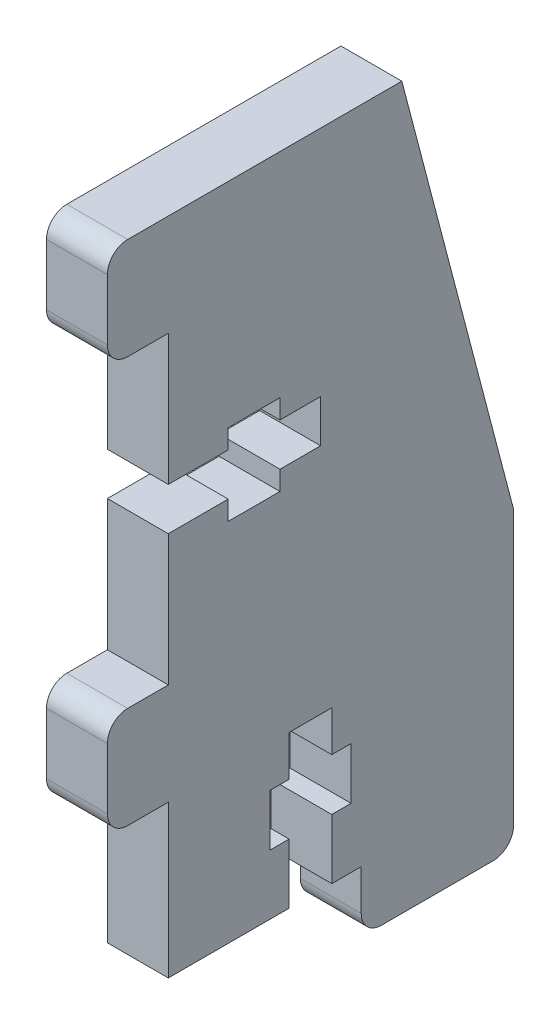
SolidWorks part; units mm, degrees
ref_plane "Спереди" through (0, 0, 0) normal (0, 0, 1) x (1, 0, 0)
ref_plane "Сверху" through (0, 0, 0) normal (0, 1, 0) x (1, 0, 0)
ref_plane "Справа" through (0, 0, 0) normal (1, 0, 0) x (0, 0, -1)
sketch "Эскиз1" plane through (0, 0, 0) normal (1, 0, 0) x (0, 0, -1)
  line L0 (23, 65) -> (34, 23)
  line L1 (0, 0) -> (34, 0)
  line L2 (0, 0) -> (0, 65)
  line L3 (0, 65) -> (23, 65)
  line L4 (34, 0) -> (34, 23)
  line L5 (0, 65) -> (-4, 65)
  line L6 (0, 65) -> (0, 55)
  line L7 (0, 55) -> (-4, 55)
  line L8 (-6, 63) -> (-6, 57)
  line L9 (0, 15) -> (-4, 15)
  line L10 (0, 15) -> (0, 25)
  line L11 (0, 25) -> (-4, 25)
  line L12 (-6, 17) -> (-6, 23)
  line L13 (0, 42.1) -> (15, 42.1)
  line L14 (0, 42.1) -> (0, 37.9)
  line L15 (0, 37.9) -> (15, 37.9)
  line L16 (15, 42.1) -> (15, 37.9)
  line L17 (5.9, 44) -> (11, 44)
  line L18 (5.9, 44) -> (5.9, 36)
  line L19 (5.9, 36) -> (11, 36)
  line L20 (11, 44) -> (11, 36)
  arc A0 (-4, 15) -> (-6, 17) centre (-4, 17) cw
  arc A1 (-4, 55) -> (-6, 57) centre (-4, 57) cw
  arc A2 (-4, 25) -> (-6, 23) centre (-4, 23) ccw
  arc A3 (-4, 65) -> (-6, 63) centre (-4, 63) ccw
  point P20 (15, 40)
  point P21 (11, 40)
  point P24 (-6, 15)
  point P27 (-6, 55)
  point P30 (-6, 25)
  point P33 (-6, 65)
  point P34 (23, 65)
  point P35 (34, 23)
extrude "Бобышка-Вытянуть1" add sketch "Эскиз1" along normal blind 6 contours L5 A3 L8 A1 L7 L2 | L11 A2 L12 A0 L9 L2 | L17 L20 L13 L16 L15 L19 L18 L2 L1 L4 L0 L3
sketch "Эскиз2" plane through (6, 0, 0) normal (1, 0, 0) x (0, 0, -1)
  line L0 (0, 0) -> (34, 0) construction
  line L1 (19, 0) -> (34, 0) construction
  line L2 (19, 0) -> (19, -4) construction
  line L3 (21, -6) -> (32, -6) construction
  line L4 (34, 0) -> (34, -4) construction
  line L6 (11.9, 0) -> (16.1, 0)
  line L7 (11.9, 0) -> (11.9, 15)
  line L8 (11.9, 15) -> (16.1, 15)
  line L9 (16.1, 0) -> (16.1, 15)
  line L10 (10, 11) -> (18, 11)
  line L11 (10, 11) -> (10, 5.9)
  line L12 (10, 5.9) -> (18, 5.9)
  line L13 (18, 11) -> (18, 5.9)
  arc A0 (32, -6) -> (34, -4) centre (32, -4) ccw construction
  arc A1 (19, -4) -> (21, -6) centre (21, -4) ccw construction
  point P15 (14, 15)
  point P16 (14, 11)
  point P19 (34, -6)
  point P23 (19, -6)
  dimension "D9" = 2
  dimension "D1" = 15
  dimension "D2" = 6
  dimension "D3" = 5
  dimension "D4" = 4
  dimension "D5" = 5.1
  dimension "D6" = 4.2
  dimension "D7" = 8
  dimension "D8" = 15
extrude "Вырез-Вытянуть1" cut sketch "Эскиз2" against normal through all contours L7 L10 L9 L8 | L11 L12 L7 L10 | L13 L10 L9 L12 | L7 L12 L9 L10 | L12 L7 L9 M31
sketch "Эскиз3" plane through (6, 0, 0) normal (1, 0, 0) x (0, 0, -1)
  line L1 (34, 0) -> (19, 0)
  line L2 (34, 0) -> (34, -4)
  line L3 (32, -6) -> (21, -6)
  line L4 (19, 0) -> (19, -4)
  arc A0 (32, -6) -> (34, -4) centre (32, -4) ccw
  arc A1 (21, -6) -> (19, -4) centre (21, -4) cw
  point P7 (34, -6)
  point P10 (19, -6)
  dimension "D3" = 2
  dimension "D1" = 15
  dimension "D2" = 6
extrude "Бобышка-Вытянуть2" add sketch "Эскиз3" against normal up to surface (6 mm away)
equation "\"D13@Эскиз1\"=\"D12@Эскиз1\"/2"
